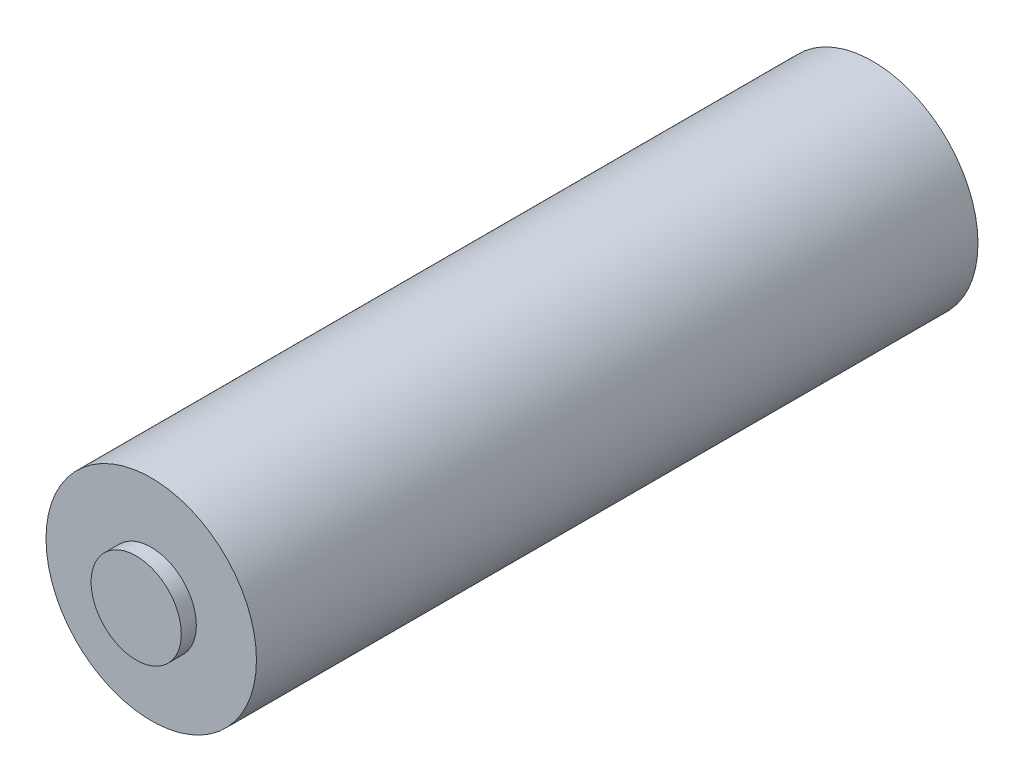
SolidWorks part; units mm, degrees
ref_plane "Plan de face" through (0, 0, 0) normal (0, 0, 1) x (1, 0, 0)
ref_plane "Plan de dessus" through (0, 0, 0) normal (0, 1, 0) x (1, 0, 0)
ref_plane "Plan de droite" through (0, 0, 0) normal (1, 0, 0) x (0, 0, -1)
sketch "Esquisse1" plane through (0, 0, 0) normal (0, 0, 1) x (1, 0, 0)
  circle A0 centre (0, 0) radius 7
extrude "Extrusion1" add sketch "Esquisse1" along normal blind 48
sketch "Esquisse2" plane through (0, 0, 48) normal (0, 0, 1) x (1, 0, 0)
  circle A0 centre (0, 0) radius 3
extrude "Extrusion2" add sketch "Esquisse2" along normal blind 1
